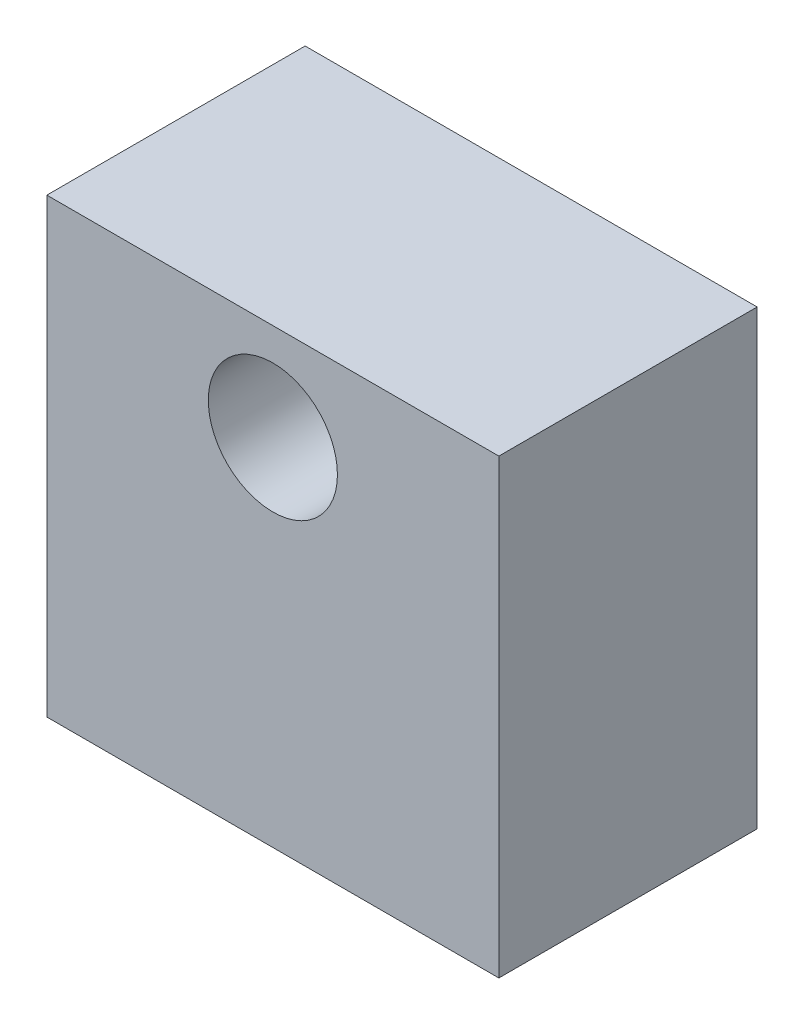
SolidWorks part; units mm, degrees
ref_plane "Спереди" through (0, 0, 0) normal (0, 0, 1) x (1, 0, 0)
ref_plane "Сверху" through (0, 0, 0) normal (0, 1, 0) x (1, 0, 0)
ref_plane "Справа" through (0, 0, 0) normal (1, 0, 0) x (0, 0, -1)
sketch "Эскиз1" plane through (0, 0, 0) normal (0, 0, 1) x (1, 0, 0)
  line L0 (0, 0) -> (0, 20) construction
  line L1 (-35, 35) -> (35, 35)
  line L2 (-35, 35) -> (-35, -35)
  line L3 (-35, -35) -> (35, -35)
  line L4 (35, 35) -> (35, -35)
  line L5 (-35, 35) -> (35, -35) construction
  line L6 (-35, -35) -> (35, 35) construction
  circle A0 centre (0, 20) radius 10
  point P0 (0, 0)
  dimension "D1" = 70
  dimension "D2" = 20
  dimension "D3" = 20
extrude "Бобышка-Вытянуть1" add sketch "Эскиз1" along normal blind 40
